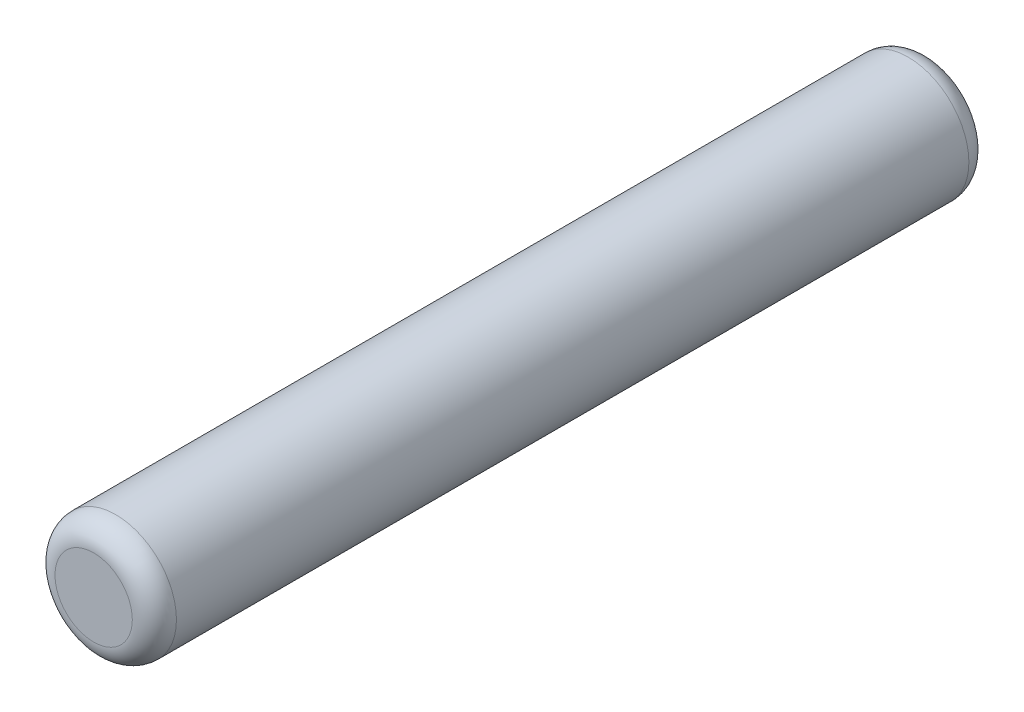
SolidWorks part; units mm, degrees
ref_plane "Спереди" through (0, 0, 0) normal (0, 0, 1) x (1, 0, 0)
ref_plane "Сверху" through (0, 0, 0) normal (0, 1, 0) x (1, 0, 0)
ref_plane "Справа" through (0, 0, 0) normal (1, 0, 0) x (0, 0, -1)
sketch "Эскиз1" plane through (0, 0, 0) normal (1, 0, 0) x (0, 0, -1)
  line L0 (-40.4233, 0) -> (48.7867, 0) construction
  line L2 (15.0495, 0) -> (-15.0495, 0)
  line L3 (15.0495, 0) -> (15.0495, 1.3906)
  line L4 (14.2558, 2.1844) -> (-14.2558, 2.1844)
  line L5 (-15.0495, 0) -> (-15.0495, 1.3906)
  arc A0 (15.0495, 1.3906) -> (14.2558, 2.1844) centre (14.2558, 1.3906) ccw
  arc A1 (-14.2558, 2.1844) -> (-15.0495, 1.3906) centre (-14.2558, 1.3906) ccw
  dimension "D3" = 0.7937
  dimension "D1" = 30.099
  dimension "D2" = 4.3688
revolve "Повернуть1" add sketch "Эскиз1" angle 360 about L0
